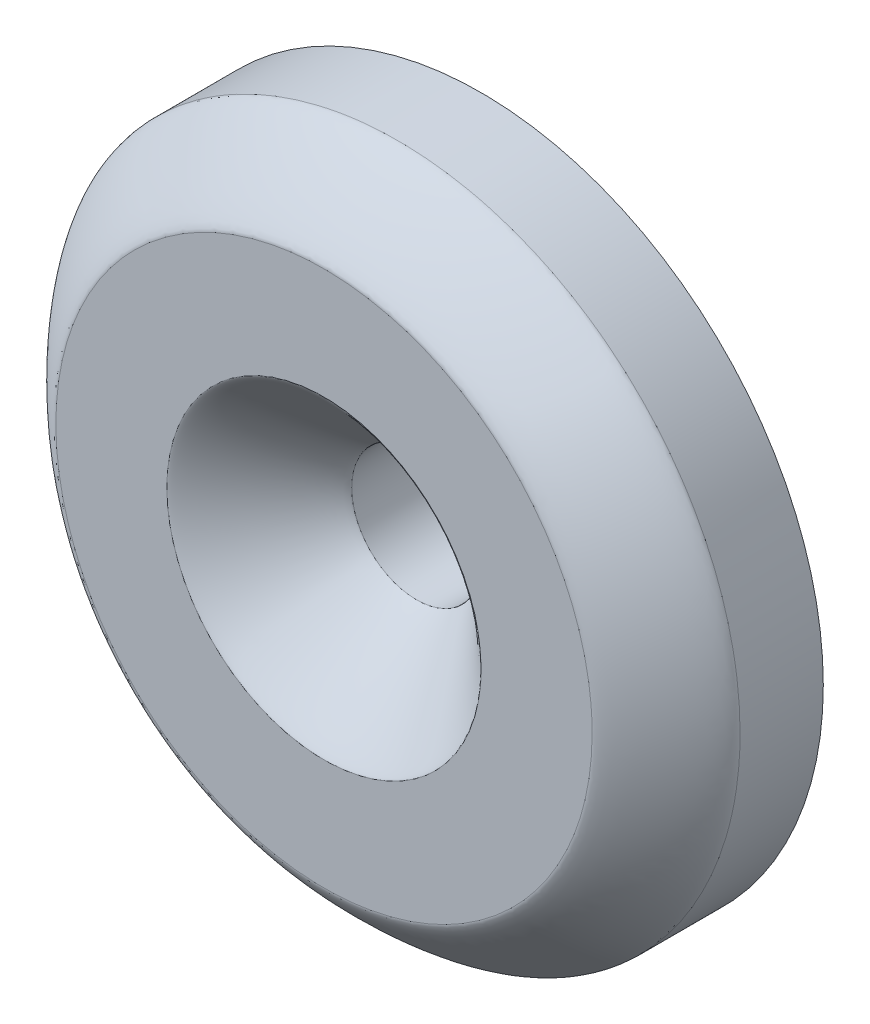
SolidWorks part; units mm, degrees
ref_plane "Front Plane" through (0, 0, 0) normal (0, 0, 1) x (1, 0, 0)
ref_plane "Top Plane" through (0, 0, 0) normal (0, 1, 0) x (1, 0, 0)
ref_plane "Right Plane" through (0, 0, 0) normal (1, 0, 0) x (0, 0, -1)
sketch "Sketch1" plane through (0, 0, 0) normal (0, 0, 1) x (1, 0, 0)
  circle A0 centre (0, 0) radius 3.5
  circle A1 centre (0, 0) radius 18.5
extrude "Boss-Extrude1" add sketch "Sketch1" along normal blind 8.5
fillet "Fillet1" radius 4 1 edges at (18.5, 0, 8.5)
fillet "Fillet2" radius 5 1 edges at (3.5, 0, 8.5)
sketch "Sketch2" plane through (0, 0, 0) normal (0, 0, -1) x (-1, 0, 0)
  circle A0 centre (0, 0) radius 6
  circle A1 centre (0, 0) radius 3.5
extrude "Boss-Extrude2" add sketch "Sketch2" along normal blind 2
sketch "Sketch3" plane through (0, 0, 0) normal (0, 0, -1) x (-1, 0, 0)
  circle A1 centre (0, 0) radius 16
  circle A2 centre (0, 0) radius 11.8
extrude "Cut-Extrude1" cut sketch "Sketch3" against normal blind 4
